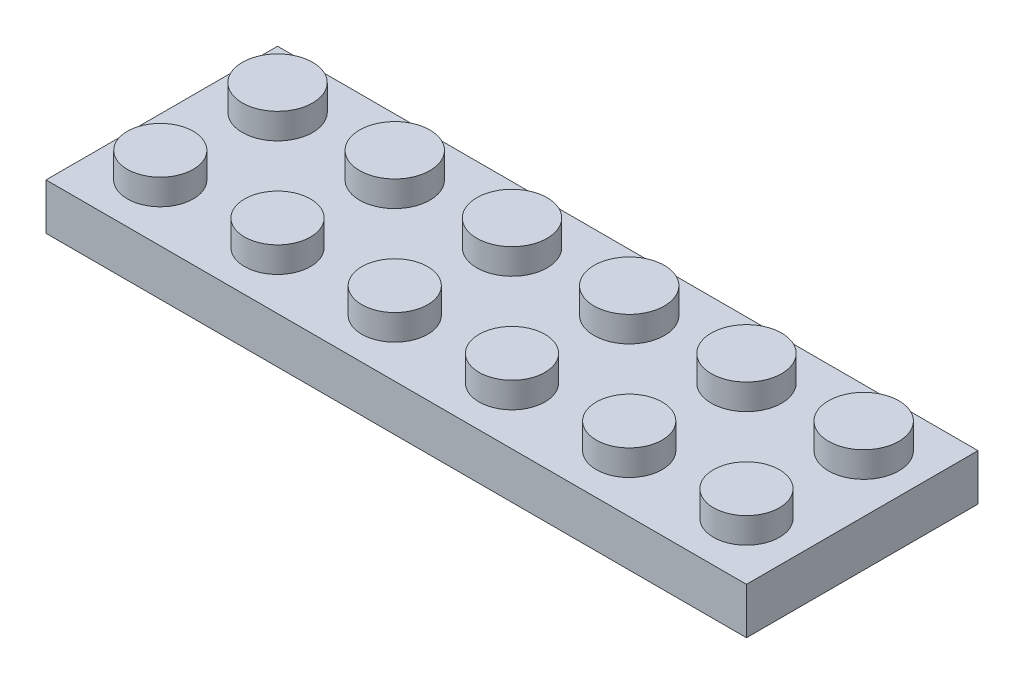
SolidWorks part; units mm, degrees
ref_plane "Front Plane" through (0, 0, 0) normal (0, 0, 1) x (1, 0, 0)
ref_plane "Top Plane" through (0, 0, 0) normal (0, 1, 0) x (1, 0, 0)
ref_plane "Right Plane" through (0, 0, 0) normal (1, 0, 0) x (0, 0, -1)
sketch "Sketch1" plane through (0, 0, 0) normal (0, 1, 0) x (1, 0, 0)
  line L1 (23.9, -7.9) -> (-23.9, -7.9)
  line L2 (23.9, -7.9) -> (23.9, 7.9)
  line L3 (23.9, 7.9) -> (-23.9, 7.9)
  line L4 (-23.9, -7.9) -> (-23.9, 7.9)
  line L5 (23.9, -7.9) -> (-23.9, 7.9) construction
  line L6 (23.9, 7.9) -> (-23.9, -7.9) construction
  point P0 (0, 0)
  dimension "D1" = 15.8
  dimension "D2" = 47.8
extrude "Extrude1" add sketch "Sketch1" along normal blind 3.16
sketch "Sketch2" plane through (0, 3.16, 0) normal (0, 1, 0) x (1, 0, 0)
  line L0 (12, -4) -> (12, -3.4252) construction
  circle A0 centre (12, 4) radius 2.4002
  circle A1 centre (12, -4) radius 2.25
  dimension "D1" = 4.8004
  dimension "D2" = 4.5
extrude "Extrude2" add sketch "Sketch2" along normal blind 1.75
sketch "Sketch3" plane through (0, 3.16, 0) normal (0, 1, 0) x (-1, 0, 0)
  line L0 (17.1927, 0) -> (-18.4099, 0) construction
sketch "Sketch4" plane through (0, 3.16, 0) normal (0, 1, 0) x (1, 0, 0)
  line L2 (-17.1927, 0) -> (18.4099, 0) construction
  line L3 (23.9, -7.9) -> (23.9, 7.9) construction
  circle A0 centre (15.9, 0) radius 2.4
  dimension "D1" = 8
  dimension "D2" = 4.8
sketch "Sketch5" plane through (0, 0, 0) normal (0, -1, 0) x (1, 0, 0)
  line L0 (-23.9, 7.9) -> (23.9, 7.9) construction
  line L1 (23.4, -7.4) -> (-23.4, -7.4)
  line L2 (23.4, -7.4) -> (23.4, 7.4)
  line L3 (23.4, 7.4) -> (-23.4, 7.4)
  line L4 (-23.4, -7.4) -> (-23.4, 7.4)
  line L5 (23.4, -7.4) -> (-23.4, 7.4) construction
  line L6 (23.4, 7.4) -> (-23.4, -7.4) construction
  line L7 (23.9, 7.9) -> (23.9, -7.9) construction
  point P0 (0, 0)
  dimension "D1" = 0.5
  dimension "D2" = 0.5
extrude "Extrude4" cut sketch "Sketch5" against normal blind 2.5
sketch "Sketch6" plane through (0, 2.5, 0) normal (0, -1, 0) x (1, 0, 0)
  line L0 (0, 0) -> (20.059, 0) construction
  line L1 (23.9, 7.9) -> (23.9, -7.9) construction
  circle A0 centre (15.9, 0) radius 3.4
  dimension "D1" = 6.8
  dimension "D2" = 8
extrude "Extrude5" add sketch "Sketch6" along normal blind 2.5
sketch "Sketch8" plane through (0, 3.16, 0) normal (0, 1, 0) x (1, 0, 0)
  line L0 (-26.3143, 0) -> (28.1957, 0) construction
pattern_linear "LPattern1" count 2 spacing 8 along (1, 0, 0) of "Extrude2"
pattern_linear "LPattern2" count 5 spacing 8 along (-1, 0, 0) of "Extrude2"
pattern_linear "LPattern3" count 5 spacing 8 along (-1, 0, 0) of "Extrude5"
